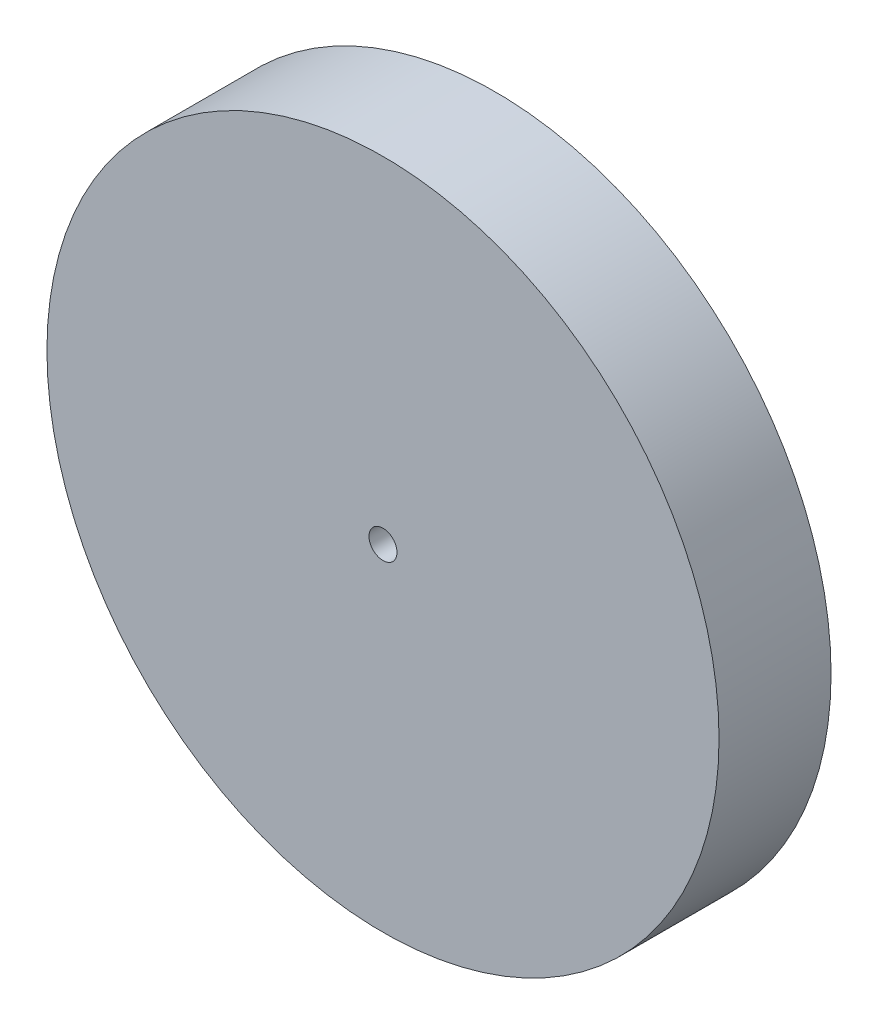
SolidWorks part; units mm, degrees
ref_plane "Front Plane" through (0, 0, 0) normal (0, 0, 1) x (1, 0, 0)
ref_plane "Top Plane" through (0, 0, 0) normal (0, 1, 0) x (1, 0, 0)
ref_plane "Right Plane" through (0, 0, 0) normal (1, 0, 0) x (0, 0, -1)
sketch "Sketch1" plane through (0, 0, 0) normal (0, 0, 1) x (1, 0, 0)
  circle A0 centre (0, 0) radius 38.1
extrude "Boss-Extrude1" add sketch "Sketch1" along normal mid plane 12.7
sketch "Sketch2" plane through (0, 0, 0) normal (0, 0, 1) x (1, 0, 0)
  circle A0 centre (0, 0) radius 1.5875
extrude "Cut-Extrude1" cut sketch "Sketch2" against normal mid plane 25.4
